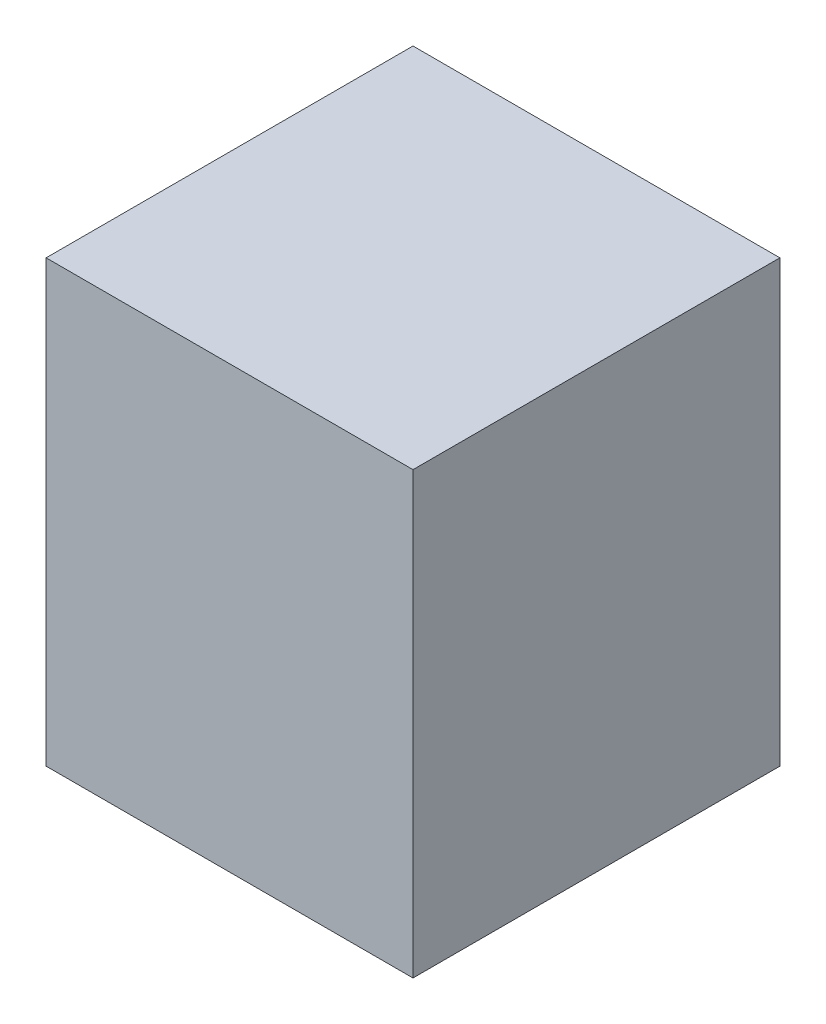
SolidWorks part; units mm, degrees
ref_plane "Front Plane" through (0, 0, 0) normal (0, 0, 1) x (1, 0, 0)
ref_plane "Top Plane" through (0, 0, 0) normal (0, 1, 0) x (1, 0, 0)
ref_plane "Right Plane" through (0, 0, 0) normal (1, 0, 0) x (0, 0, -1)
sketch "Sketch1" plane through (0, 0, 0) normal (0, 1, 0) x (1, 0, 0)
  line L1 (-25, -25) -> (25, -25)
  line L2 (-25, -25) -> (-25, 25)
  line L3 (-25, 25) -> (25, 25)
  line L4 (25, -25) -> (25, 25)
  line L5 (-25, -25) -> (25, 25) construction
  line L6 (-25, 25) -> (25, -25) construction
  point P0 (0, 0)
  dimension "D1" = 50
extrude "Boss-Extrude1" add sketch "Sketch1" along normal blind 60
